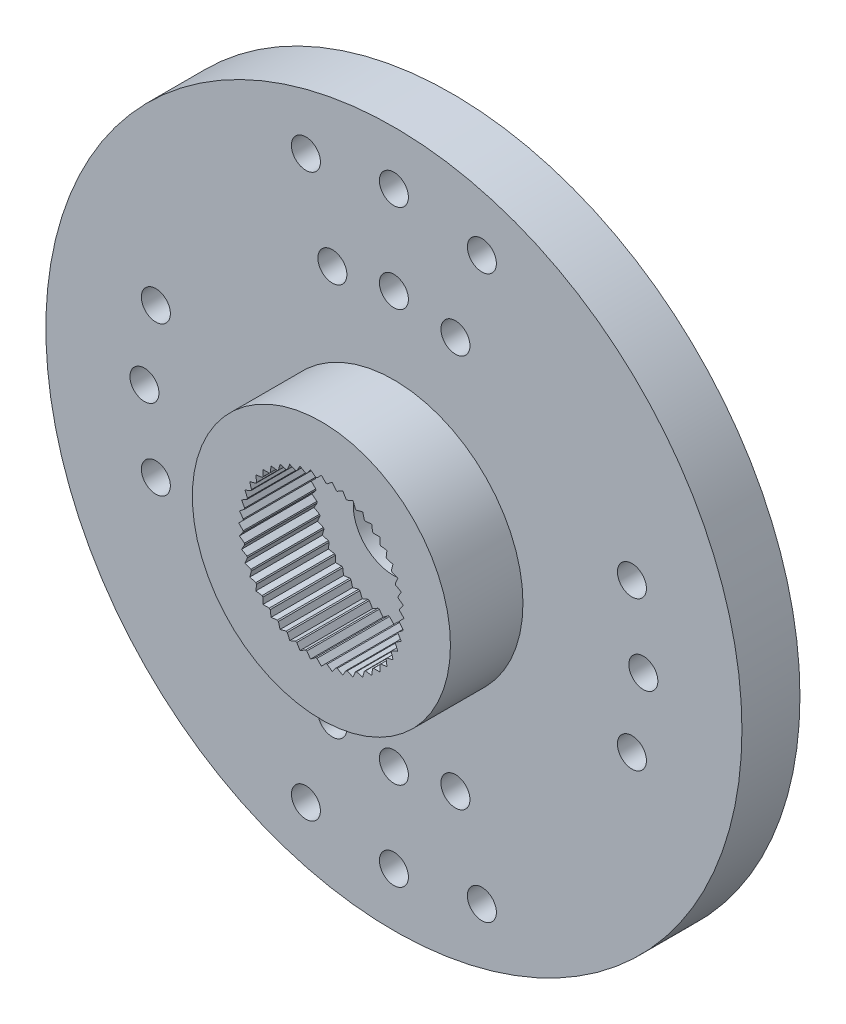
SolidWorks part; units mm, degrees
ref_plane "Plan de face" through (0, 0, 0) normal (0, 0, 1) x (1, 0, 0)
ref_plane "Plan de dessus" through (0, 0, 0) normal (0, 1, 0) x (1, 0, 0)
ref_plane "Plan de droite" through (0, 0, 0) normal (1, 0, 0) x (0, 0, -1)
sketch "Esquisse2" plane through (0, 0, 0) normal (0, 0, 1) x (1, 0, 0)
  line L0 (0, 2.85) -> (-0.1544, 2.6956)
  line L1 (0, 2.85) -> (0.1544, 2.6956)
  line L2 (0, 2.85) -> (0, 2.7) construction
  line L3 (0.372, 2.8256) -> (0.1987, 2.6927)
  line L4 (0.372, 2.8256) -> (0.5049, 2.6524)
  line L5 (0.7376, 2.7529) -> (0.5485, 2.6437)
  line L6 (0.7376, 2.7529) -> (0.8468, 2.5638)
  line L7 (1.0906, 2.6331) -> (0.8889, 2.5495)
  line L8 (1.0906, 2.6331) -> (1.1742, 2.4313)
  line L9 (1.425, 2.4682) -> (1.2141, 2.4117)
  line L10 (1.425, 2.4682) -> (1.4815, 2.2572)
  line L11 (1.735, 2.2611) -> (1.5185, 2.2326)
  line L12 (1.735, 2.2611) -> (1.7635, 2.0445)
  line L13 (2.0153, 2.0153) -> (1.7969, 2.0153)
  line L14 (2.0153, 2.0153) -> (2.0153, 1.7969)
  line L15 (2.2611, 1.735) -> (2.0445, 1.7635)
  line L16 (2.2611, 1.735) -> (2.2326, 1.5185)
  line L17 (2.4682, 1.425) -> (2.2572, 1.4815)
  line L18 (2.4682, 1.425) -> (2.4117, 1.2141)
  line L19 (2.6331, 1.0906) -> (2.4313, 1.1742)
  line L20 (2.6331, 1.0906) -> (2.5495, 0.8889)
  line L21 (2.7529, 0.7376) -> (2.5638, 0.8468)
  line L22 (2.7529, 0.7376) -> (2.6437, 0.5485)
  line L23 (2.8256, 0.372) -> (2.6524, 0.5049)
  line L24 (2.8256, 0.372) -> (2.6927, 0.1987)
  line L25 (2.85, 0) -> (2.6956, 0.1544)
  line L26 (2.85, 0) -> (2.6956, -0.1544)
  line L27 (2.8256, -0.372) -> (2.6927, -0.1987)
  line L28 (2.8256, -0.372) -> (2.6524, -0.5049)
  line L29 (2.7529, -0.7376) -> (2.6437, -0.5485)
  line L30 (2.7529, -0.7376) -> (2.5638, -0.8468)
  line L31 (2.6331, -1.0906) -> (2.5495, -0.8889)
  line L32 (2.6331, -1.0906) -> (2.4313, -1.1742)
  line L33 (2.4682, -1.425) -> (2.4117, -1.2141)
  line L34 (2.4682, -1.425) -> (2.2572, -1.4815)
  line L35 (2.2611, -1.735) -> (2.2326, -1.5185)
  line L36 (2.2611, -1.735) -> (2.0445, -1.7635)
  line L37 (2.0153, -2.0153) -> (2.0153, -1.7969)
  line L38 (2.0153, -2.0153) -> (1.7969, -2.0153)
  line L39 (1.735, -2.2611) -> (1.7635, -2.0445)
  line L40 (1.735, -2.2611) -> (1.5185, -2.2326)
  line L41 (1.425, -2.4682) -> (1.4815, -2.2572)
  line L42 (1.425, -2.4682) -> (1.2141, -2.4117)
  line L43 (1.0906, -2.6331) -> (1.1742, -2.4313)
  line L44 (1.0906, -2.6331) -> (0.8889, -2.5495)
  line L45 (0.7376, -2.7529) -> (0.8468, -2.5638)
  line L46 (0.7376, -2.7529) -> (0.5485, -2.6437)
  line L47 (0.372, -2.8256) -> (0.5049, -2.6524)
  line L48 (0.372, -2.8256) -> (0.1987, -2.6927)
  line L49 (0, -2.85) -> (0.1544, -2.6956)
  line L50 (0, -2.85) -> (-0.1544, -2.6956)
  line L51 (-0.372, -2.8256) -> (-0.1987, -2.6927)
  line L52 (-0.372, -2.8256) -> (-0.5049, -2.6524)
  line L53 (-0.7376, -2.7529) -> (-0.5485, -2.6437)
  line L54 (-0.7376, -2.7529) -> (-0.8468, -2.5638)
  line L55 (-1.0906, -2.6331) -> (-0.8889, -2.5495)
  line L56 (-1.0906, -2.6331) -> (-1.1742, -2.4313)
  line L57 (-1.425, -2.4682) -> (-1.2141, -2.4117)
  line L58 (-1.425, -2.4682) -> (-1.4815, -2.2572)
  line L59 (-1.735, -2.2611) -> (-1.5185, -2.2326)
  line L60 (-1.735, -2.2611) -> (-1.7635, -2.0445)
  line L61 (-2.0153, -2.0153) -> (-1.7969, -2.0153)
  line L62 (-2.0153, -2.0153) -> (-2.0153, -1.7969)
  line L63 (-2.2611, -1.735) -> (-2.0445, -1.7635)
  line L64 (-2.2611, -1.735) -> (-2.2326, -1.5185)
  line L65 (-2.4682, -1.425) -> (-2.2572, -1.4815)
  line L66 (-2.4682, -1.425) -> (-2.4117, -1.2141)
  line L67 (-2.6331, -1.0906) -> (-2.4313, -1.1742)
  line L68 (-2.6331, -1.0906) -> (-2.5495, -0.8889)
  line L69 (-2.7529, -0.7376) -> (-2.5638, -0.8468)
  line L70 (-2.7529, -0.7376) -> (-2.6437, -0.5485)
  line L71 (-2.8256, -0.372) -> (-2.6524, -0.5049)
  line L72 (-2.8256, -0.372) -> (-2.6927, -0.1987)
  line L73 (-2.85, 0) -> (-2.6956, -0.1544)
  line L74 (-2.85, 0) -> (-2.6956, 0.1544)
  line L75 (-2.8256, 0.372) -> (-2.6927, 0.1987)
  line L76 (-2.8256, 0.372) -> (-2.6524, 0.5049)
  line L77 (-2.7529, 0.7376) -> (-2.6437, 0.5485)
  line L78 (-2.7529, 0.7376) -> (-2.5638, 0.8468)
  line L79 (-2.6331, 1.0906) -> (-2.5495, 0.8889)
  line L80 (-2.6331, 1.0906) -> (-2.4313, 1.1742)
  line L81 (-2.4682, 1.425) -> (-2.4117, 1.2141)
  line L82 (-2.4682, 1.425) -> (-2.2572, 1.4815)
  line L83 (-2.2611, 1.735) -> (-2.2326, 1.5185)
  line L84 (-2.2611, 1.735) -> (-2.0445, 1.7635)
  line L85 (-2.0153, 2.0153) -> (-2.0153, 1.7969)
  line L86 (-2.0153, 2.0153) -> (-1.7969, 2.0153)
  line L87 (-1.735, 2.2611) -> (-1.7635, 2.0445)
  line L88 (-1.735, 2.2611) -> (-1.5185, 2.2326)
  line L89 (-1.425, 2.4682) -> (-1.4815, 2.2572)
  line L90 (-1.425, 2.4682) -> (-1.2141, 2.4117)
  line L91 (-1.0906, 2.6331) -> (-1.1742, 2.4313)
  line L92 (-1.0906, 2.6331) -> (-0.8889, 2.5495)
  line L93 (-0.7376, 2.7529) -> (-0.8468, 2.5638)
  line L94 (-0.7376, 2.7529) -> (-0.5485, 2.6437)
  line L95 (-0.372, 2.8256) -> (-0.5049, 2.6524)
  line L96 (-0.372, 2.8256) -> (-0.1987, 2.6927)
  circle A0 centre (0, 0) radius 2.85 construction
  circle A1 centre (0, 0) radius 2.7 construction
  arc A2 (2.6956, 0.1544) -> (2.6927, 0.1987) centre (0, 0) ccw
  arc A3 (2.6524, 0.5049) -> (2.6437, 0.5485) centre (0, 0) ccw
  arc A4 (2.5638, 0.8468) -> (2.5495, 0.8889) centre (0, 0) ccw
  arc A5 (2.4313, 1.1742) -> (2.4117, 1.2141) centre (0, 0) ccw
  arc A6 (2.2572, 1.4815) -> (2.2326, 1.5185) centre (0, 0) ccw
  arc A7 (2.0445, 1.7635) -> (2.0153, 1.7969) centre (0, 0) ccw
  arc A8 (1.7969, 2.0153) -> (1.7635, 2.0445) centre (0, 0) ccw
  arc A9 (1.5185, 2.2326) -> (1.4815, 2.2572) centre (0, 0) ccw
  arc A10 (1.2141, 2.4117) -> (1.1742, 2.4313) centre (0, 0) ccw
  arc A11 (0.8889, 2.5495) -> (0.8468, 2.5638) centre (0, 0) ccw
  arc A12 (0.5485, 2.6437) -> (0.5049, 2.6524) centre (0, 0) ccw
  arc A13 (0.1987, 2.6927) -> (0.1544, 2.6956) centre (0, 0) ccw
  arc A14 (-0.1544, 2.6956) -> (-0.1987, 2.6927) centre (0, 0) ccw
  arc A15 (-0.5049, 2.6524) -> (-0.5485, 2.6437) centre (0, 0) ccw
  arc A16 (-0.8468, 2.5638) -> (-0.8889, 2.5495) centre (0, 0) ccw
  arc A17 (-1.1742, 2.4313) -> (-1.2141, 2.4117) centre (0, 0) ccw
  arc A18 (-1.4815, 2.2572) -> (-1.5185, 2.2326) centre (0, 0) ccw
  arc A19 (-1.7635, 2.0445) -> (-1.7969, 2.0153) centre (0, 0) ccw
  arc A20 (-2.0153, 1.7969) -> (-2.0445, 1.7635) centre (0, 0) ccw
  arc A21 (-2.2326, 1.5185) -> (-2.2572, 1.4815) centre (0, 0) ccw
  arc A22 (-2.4117, 1.2141) -> (-2.4313, 1.1742) centre (0, 0) ccw
  arc A23 (-2.5495, 0.8889) -> (-2.5638, 0.8468) centre (0, 0) ccw
  arc A24 (-2.6437, 0.5485) -> (-2.6524, 0.5049) centre (0, 0) ccw
  arc A25 (-2.6927, 0.1987) -> (-2.6956, 0.1544) centre (0, 0) ccw
  arc A26 (-2.6956, -0.1544) -> (-2.6927, -0.1987) centre (0, 0) ccw
  arc A27 (-2.6524, -0.5049) -> (-2.6437, -0.5485) centre (0, 0) ccw
  arc A28 (-2.5638, -0.8468) -> (-2.5495, -0.8889) centre (0, 0) ccw
  arc A29 (-2.4313, -1.1742) -> (-2.4117, -1.2141) centre (0, 0) ccw
  arc A30 (-2.2572, -1.4815) -> (-2.2326, -1.5185) centre (0, 0) ccw
  arc A31 (-2.0445, -1.7635) -> (-2.0153, -1.7969) centre (0, 0) ccw
  arc A32 (-1.7969, -2.0153) -> (-1.7635, -2.0445) centre (0, 0) ccw
  arc A33 (-1.5185, -2.2326) -> (-1.4815, -2.2572) centre (0, 0) ccw
  arc A34 (-1.2141, -2.4117) -> (-1.1742, -2.4313) centre (0, 0) ccw
  arc A35 (-0.8889, -2.5495) -> (-0.8468, -2.5638) centre (0, 0) ccw
  arc A36 (-0.5485, -2.6437) -> (-0.5049, -2.6524) centre (0, 0) ccw
  arc A37 (-0.1987, -2.6927) -> (-0.1544, -2.6956) centre (0, 0) ccw
  arc A38 (0.1544, -2.6956) -> (0.1987, -2.6927) centre (0, 0) ccw
  arc A39 (0.5049, -2.6524) -> (0.5485, -2.6437) centre (0, 0) ccw
  arc A40 (0.8468, -2.5638) -> (0.8889, -2.5495) centre (0, 0) ccw
  arc A41 (1.1742, -2.4313) -> (1.2141, -2.4117) centre (0, 0) ccw
  arc A42 (1.4815, -2.2572) -> (1.5185, -2.2326) centre (0, 0) ccw
  arc A43 (1.7635, -2.0445) -> (1.7969, -2.0153) centre (0, 0) ccw
  arc A44 (2.0153, -1.7969) -> (2.0445, -1.7635) centre (0, 0) ccw
  arc A45 (2.2326, -1.5185) -> (2.2572, -1.4815) centre (0, 0) ccw
  arc A46 (2.6927, -0.1987) -> (2.6956, -0.1544) centre (0, 0) ccw
  arc A47 (2.6437, -0.5485) -> (2.6524, -0.5049) centre (0, 0) ccw
  arc A48 (2.5495, -0.8889) -> (2.5638, -0.8468) centre (0, 0) ccw
  arc A49 (2.4117, -1.2141) -> (2.4313, -1.1742) centre (0, 0) ccw
  circle A50 centre (0, 0) radius 4.45
  dimension "D1" = 5.7
  dimension "D2" = 5.4
  dimension "D6" = 8.9
  dimension "D3" = 135
  dimension "D4" = 45
  dimension "D5" = 48
extrude "Boss.-Extru.1" add sketch "Esquisse2" along normal blind 3.2
sketch "Esquisse3" plane through (0, 0, 3.2) normal (0, 0, 1) x (1, 0, 0)
  line L0 (0, 0) -> (-18.7722, 0) construction
  line L1 (0, 0) -> (-3.0333, 9.6861) construction
  line L2 (0, 0) -> (0, 10.15) construction
  line L3 (0, 0) -> (3.0333, 9.6861) construction
  line L4 (0, 0) -> (3.0333, -9.6861) construction
  line L5 (0, 0) -> (0, -10.15) construction
  line L6 (0, 0) -> (-3.0333, -9.6861) construction
  circle A0 centre (0, 0) radius 12
  circle A1 centre (0, 0) radius 7.1 construction
  circle A2 centre (0, 0) radius 8.6 construction
  circle A3 centre (0, 0) radius 10.15 construction
  circle A4 centre (-8.6, 0) radius 0.5
  circle A5 centre (-8.207, 2.5701) radius 0.5
  circle A6 centre (-8.207, -2.5701) radius 0.5
  circle A7 centre (8.207, -2.5701) radius 0.5
  circle A8 centre (8.6, 0) radius 0.5
  circle A9 centre (8.207, 2.5701) radius 0.5
  circle A10 centre (2.5701, 8.207) radius 0.5 construction
  circle A11 centre (0, 8.6) radius 0.5 construction
  circle A12 centre (-2.5701, 8.207) radius 0.5 construction
  circle A14 centre (-3.0333, 9.6861) radius 0.5
  circle A15 centre (0, 10.15) radius 0.5
  circle A16 centre (3.0333, 9.6861) radius 0.5
  circle A17 centre (2.1218, 6.7755) radius 0.5
  circle A18 centre (0, 7.1) radius 0.5
  circle A19 centre (-2.1218, 6.7755) radius 0.5
  circle A20 centre (3.0333, -9.6861) radius 0.5
  circle A21 centre (2.1218, -6.7755) radius 0.5
  circle A22 centre (0, -10.15) radius 0.5
  circle A23 centre (-3.0333, -9.6861) radius 0.5
  circle A24 centre (-2.1218, -6.7755) radius 0.5
  circle A25 centre (0, -7.1) radius 0.5
  dimension "D1" = 24
  dimension "D2" = 17.2
  dimension "D3" = 1
  dimension "D6" = 14.2
  dimension "D8" = 20.3
  dimension "D4" = 2.6
  dimension "D5" = 2
  dimension "D7" = 2
  dimension "D9" = 2
extrude "Boss.-Extru.2" add sketch "Esquisse3" against normal blind 2 from offset 2.5
sketch "Esquisse4" plane through (0, 0, -1.3) normal (0, 0, -1) x (-1, 0, 0)
  circle A0 centre (0, 0) radius 1.4
  dimension "D1" = 2.8
extrude "Enlèv. mat.-Extru.1" cut sketch "Esquisse4" against normal through all
sketch "Esquisse5" plane through (0, 0, -1.3) normal (0, 0, -1) x (-1, 0, 0)
  circle A0 centre (0, 0) radius 3.7
  dimension "D1" = 7.4
extrude "Extru.-Mince1" add sketch "Esquisse5" along normal blind 0.4 thin
